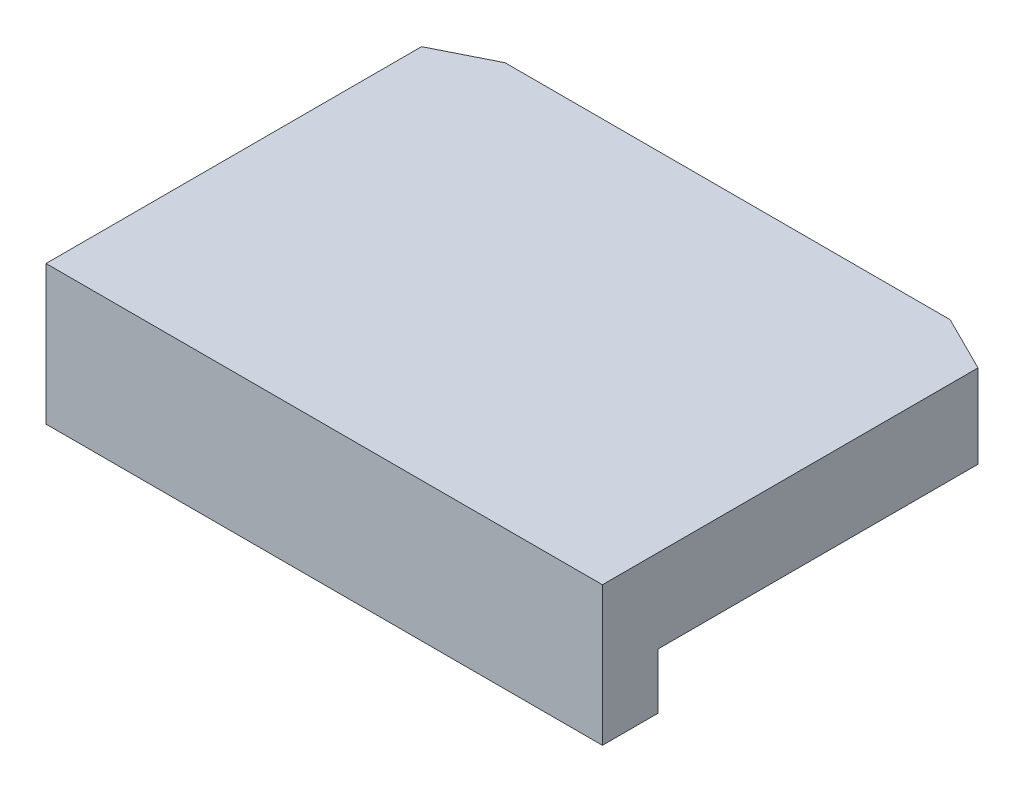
SolidWorks part; units mm, degrees
ref_plane "前视基准面" through (0, 0, 0) normal (0, 0, 1) x (1, 0, 0)
ref_plane "上视基准面" through (0, 0, 0) normal (0, 1, 0) x (1, 0, 0)
ref_plane "右视基准面" through (0, 0, 0) normal (1, 0, 0) x (0, 0, -1)
sketch "草图1" plane through (0, 0, 0) normal (0, 0, 1) x (1, 0, 0)
  line L0 (0, 0) -> (20, 0)
  line L1 (0, 5) -> (20, 5)
  line L2 (0, 0) -> (0, 5)
  line L3 (20, 0) -> (20, 5)
extrude "凸台-拉伸1" add sketch "草图1" along normal blind 14.5
sketch "草图2" plane through (20, 0, 0) normal (1, 0, 0) x (0, 0, -1)
  line L0 (-14.5, 5) -> (0, 5)
  line L1 (-12.5, 2) -> (0, 2)
  line L2 (0, 2) -> (0, 5)
  line L3 (-12.5, 0) -> (-12.5, 2)
  line L4 (-14.5, 0) -> (-14.5, 5)
  line L5 (-14.5, 0) -> (-12.5, 0)
extrude "切除-拉伸1" cut sketch "草图2" against normal through all flip side to cut
sketch "草图3" plane through (0, 5, 0) normal (0, 1, 0) x (1, 0, 0)
  line L0 (0, -14.5) -> (0, -1)
  line L1 (20, -14.5) -> (20, -1)
  line L2 (2, 0) -> (18, 0)
  line L3 (0, -14.5) -> (20, -14.5)
  line L4 (18, 0) -> (20, -1)
  line L5 (2, 0) -> (0, -1)
extrude "切除-拉伸2" cut sketch "草图3" against normal blind 14.5 flip side to cut
